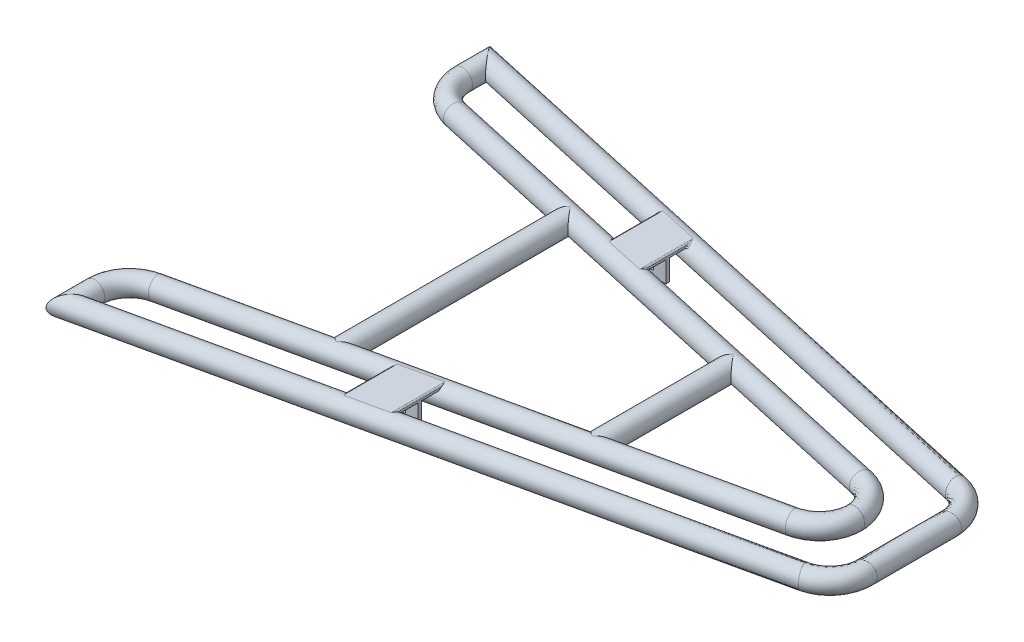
SolidWorks part; units mm, degrees
ref_plane "Front Plane" through (0, 0, 0) normal (0, 0, 1) x (1, 0, 0)
ref_plane "Top Plane" through (0, 0, 0) normal (0, 1, 0) x (1, 0, 0)
ref_plane "Right Plane" through (0, 0, 0) normal (1, 0, 0) x (0, 0, -1)
sketch "Sketch1" plane through (0, 0, 0) normal (0, 1, 0) x (1, 0, 0)
  line L0 (0, 0) -> (860.822, -190.8396)
  line L1 (900, -239.6544) -> (900, -360.3456)
  line L2 (860.822, -409.1604) -> (0, -600)
  line L3 (0, -600) -> (0, -563.3083)
  line L4 (39.178, -85.5065) -> (785.822, -251.0335)
  line L5 (825, -299.8483) -> (825, -300.1517)
  line L6 (785.822, -348.9665) -> (39.178, -514.4935)
  line L7 (0, -36.6917) -> (0, 0)
  line L8 (825, -340.2809) -> (75, -506.5519) construction
  line L9 (75, -93.4481) -> (825, -259.7191) construction
  line L10 (75, -506.5519) -> (75, -93.4481) construction
  line L11 (825, -259.7191) -> (825, -340.2809) construction
  line L12 (0, -600) -> (0, 0) construction
  line L13 (900, -199.5252) -> (900, -400.4748) construction
  line L14 (900, -400.4748) -> (0, -600) construction
  line L15 (0, 0) -> (900, -199.5252) construction
  arc A0 (39.178, -85.5065) -> (0, -36.6917) centre (50, -36.6917) cw
  arc A1 (785.822, -251.0335) -> (825, -299.8483) centre (775, -299.8483) cw
  arc A2 (825, -300.1517) -> (785.822, -348.9665) centre (775, -300.1517) cw
  arc A3 (900, -360.3456) -> (860.822, -409.1604) centre (850, -360.3456) cw
  arc A4 (860.822, -190.8396) -> (900, -239.6544) centre (850, -239.6544) cw
  arc A5 (39.178, -514.4935) -> (0, -563.3083) centre (50, -563.3083) ccw
  point P13 (0, -76.821)
  dimension "D6" = 50
  dimension "D1" = 77.5
  dimension "D2" = 77.5
  dimension "D3" = 900
  dimension "D4" = 75
  dimension "D5" = 600
sketch "Sketch2" plane through (0, 0, 0) normal (1, 0, 0) x (0, 0, -1)
  circle A0 centre (0, 0) radius 15
  dimension "D1" = 30
sweep "Sweep1" add profiles "Sketch2" path "Sketch1"
ref_plane "Plane1" through (0, 0, 300) normal (0, 0, 1) x (1, 0, 0)
sketch "Sketch6" plane through (0, 0, 300) normal (0, 0, 1) x (1, 0, 0)
  circle A0 centre (250, 0) radius 15
  circle A1 centre (550, 0) radius 15
  dimension "D1" = 250
  dimension "D2" = 300
extrude "Extrude2" add sketch "Sketch6" along normal up to next and the other way up to next
ref_plane "Plane2" through (0, 0, 125) normal (0, 0, 1) x (1, 0, 0)
sketch "Sketch8" plane through (0, 0, 125) normal (0, 0, 1) x (1, 0, 0)
  line L1 (319.7767, 10) -> (379.7767, 10)
  line L2 (319.7767, 10) -> (319.7767, 15)
  line L3 (319.7767, 15) -> (379.7767, 15)
  line L4 (379.7767, 10) -> (379.7767, 15)
  line L5 (319.7767, 10) -> (379.7767, 15) construction
  line L6 (319.7767, 15) -> (379.7767, 10) construction
  point P0 (349.7767, 12.5)
  dimension "D1" = 350
  dimension "D2" = 60
  dimension "D3" = 5
  dimension "D4" = 15
extrude "Extrude4" add sketch "Sketch8" along normal up to next and the other way up to next
sketch "Sketch9" plane through (0, 10, 0) normal (0, -1, 0) x (1, 0, 0)
  line L0 (319.7767, 82.0731) -> (319.7767, 136.5332) construction
  line L1 (319.7767, 125) -> (379.7767, 125)
  line L3 (319.7767, 120) -> (379.7767, 120)
  line L5 (319.7767, 120) -> (319.7767, 125)
  line L6 (379.7767, 95.3748) -> (379.7767, 149.8349) construction
  line L7 (379.7767, 120) -> (379.7767, 125)
  dimension "D1" = 120
  dimension "D2" = 319.7767
  dimension "D3" = 5
extrude "Extrude5" add sketch "Sketch9" along normal blind 30
fillet "Fillet1" radius 2 6 edges at (319.7767, 13.1386, 140.4766) (319.7767, 14.2252, 75.6512) (379.7767, 13.1019, 91.4979) (319.7767, 15, 109.3032) (379.7767, 15, 122.6049) (379.7767, 14.7801, 158.4565)
sketch "Sketch11" plane through (0, 0, 120) normal (0, 0, -1) x (-1, 0, 0)
  line L2 (-319.7767, -20) -> (-379.7767, -20) construction
  line L3 (-319.7767, -20) -> (-319.7767, 10) construction
  circle A0 centre (-359.7767, -10) radius 2.5
  circle A1 centre (-339.7767, -10) radius 2.5
  dimension "D1" = 5
  dimension "D2" = 5
  dimension "D3" = 20
  dimension "D4" = 20
  dimension "D5" = 10
  dimension "D6" = 10
extrude "Extrude6" cut sketch "Sketch11" against normal up to next
ref_plane "Plane3" through (0, 0, 300) normal (0, 0, 1) x (1, 0, 0)
mirror "Mirror1" about plane through (0, 0, 300) normal (0, 0, 1) of "Extrude6", "Fillet1", "Extrude5", "Extrude4"
